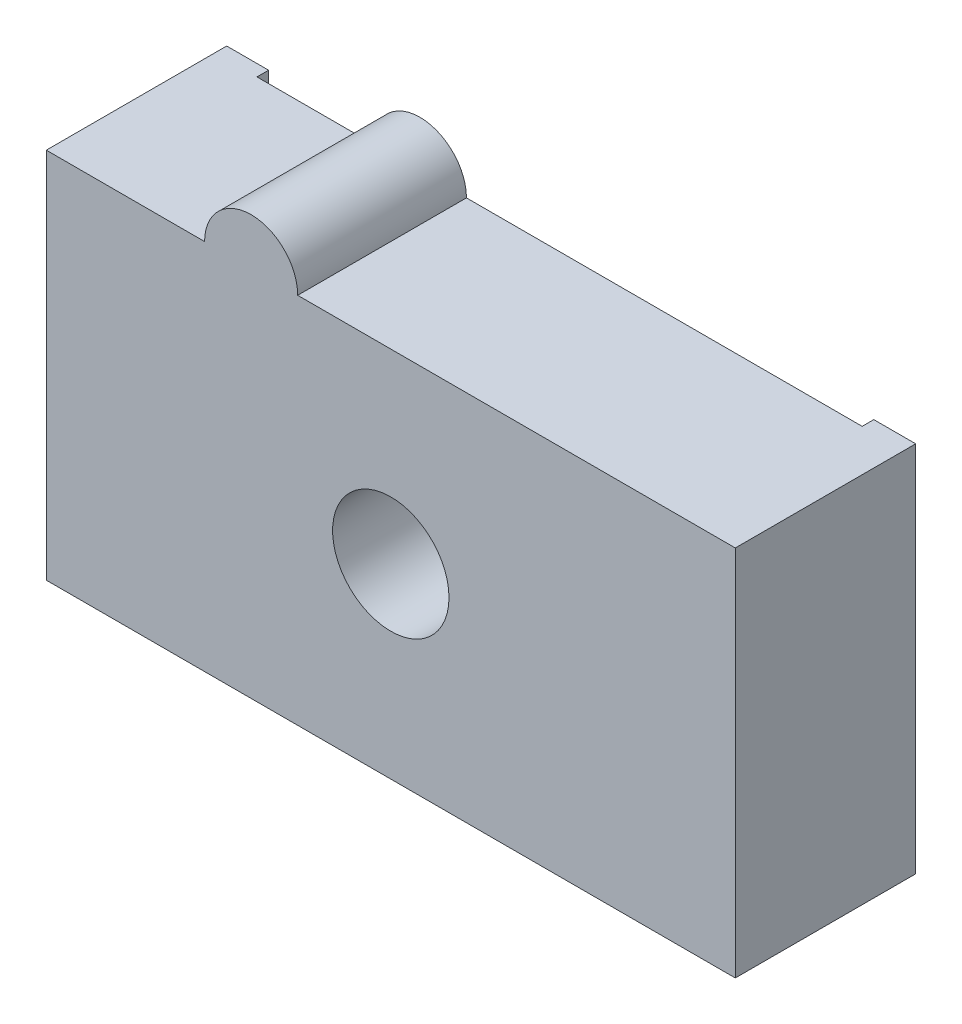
SolidWorks part; units mm, degrees
ref_plane "XZ (Face)" through (0, 0, 0) normal (0, 0, 1) x (1, 0, 0)
ref_plane "XY (Dessus)" through (0, 0, 0) normal (0, 1, 0) x (1, 0, 0)
ref_plane "YZ (Droite)" through (0, 0, 0) normal (1, 0, 0) x (0, 0, -1)
sketch "Esquisse1" plane through (0, 0, 0) normal (0, 0, 1) x (1, 0, 0)
  line L0 (-2, -10) -> (7.4, -10) construction
  line L1 (-7.4, -10) -> (-4, -10) construction
  line L2 (-7.4, -18) -> (-7.4, -10) construction
  line L3 (7.4, -18) -> (7.4, -10) construction
  line L4 (-6.5, -18) -> (6.5, -18) construction
  line L5 (-2, -10) -> (7.4, -10)
  line L6 (-7.4, -10) -> (-4, -10)
  line L7 (-7.4, -18) -> (-7.4, -10)
  line L8 (7.4, -18) -> (7.4, -10)
  line L9 (-7.4, -18) -> (7.4, -18)
  arc A0 (-2, -10) -> (-4, -10) centre (-3, -10) ccw construction
  arc A1 (-2, -10) -> (-4, -10) centre (-3, -10) ccw
extrude "Base-Extrusion" add sketch "Esquisse1" along normal blind 3.875
sketch "Esquisse2" plane through (0, 0, 0) normal (0, 0, -1) x (-1, 0, 0)
  circle A0 centre (-4.9938, -11.6952) radius 1 construction
  circle A1 centre (-4.9938, -11.6952) radius 1
  circle A2 centre (4.9938, -16.3048) radius 1 construction
  circle A3 centre (4.9938, -16.3048) radius 1
extrude "Enlèv. mat.-Extru.1" cut sketch "Esquisse2" against normal blind 3
sketch "Esquisse3" plane through (0, 0, 3.875) normal (0, 0, 1) x (1, 0, 0)
  circle A0 centre (0, -14) radius 1.25
  dimension "D1" = 2.5
extrude "Enlèv. mat.-Extru.2" cut sketch "Esquisse3" against normal through all
sketch "Esquisse4" plane through (0, 0, 0) normal (0, 0, -1) x (-1, 0, 0)
  line L0 (6.5, -10) -> (6.5, -35.5) construction
  line L1 (6.5, -6) -> (6.5, -18)
  line L2 (-6.5, -35.5) -> (-6.5, -10) construction
  line L3 (-6.5, -18) -> (-6.5, -6)
  line L5 (-6.5, -6) -> (6.5, -6)
  line L6 (7.4, -18) -> (-7.4, -18) construction
  line L7 (6.5, -18) -> (-6.5, -18)
extrude "Enlèv. mat.-Extru.3" cut sketch "Esquisse4" against normal up to surface (0.25 mm away)
